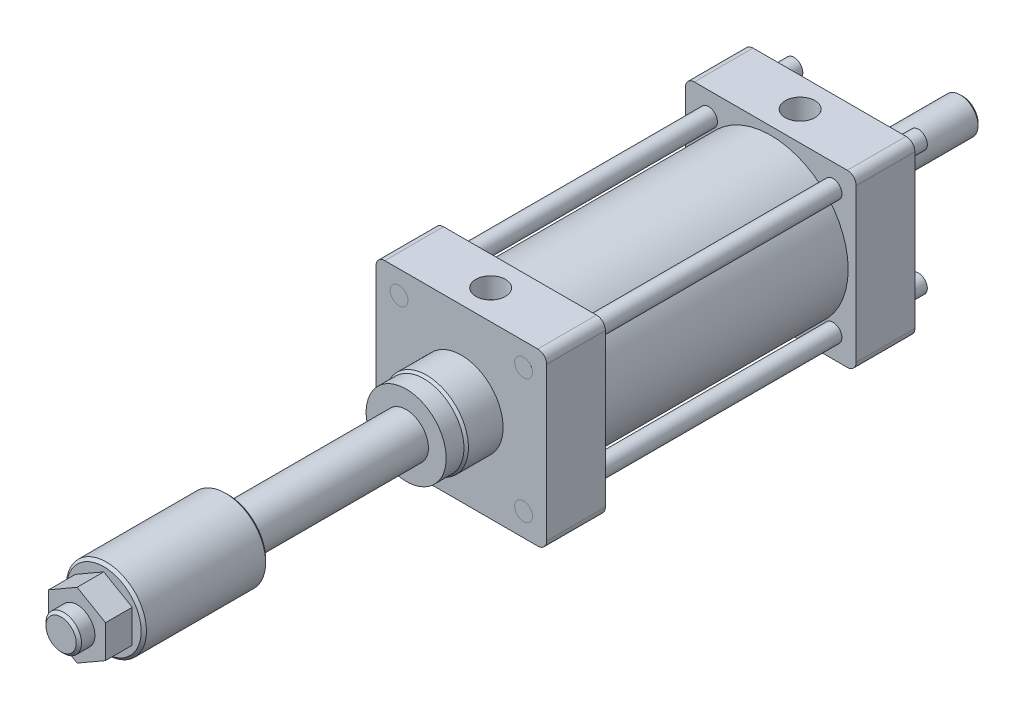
SolidWorks part; units mm, degrees
ref_plane "前视基准面" through (0, 0, 0) normal (0, 0, 1) x (1, 0, 0)
ref_plane "上视基准面" through (0, 0, 0) normal (0, 1, 0) x (1, 0, 0)
ref_plane "右视基准面" through (0, 0, 0) normal (1, 0, 0) x (0, 0, -1)
sketch "草图1" plane through (0, 0, 0) normal (0, 0, 1) x (1, 0, 0)
  line L0 (0, 0) -> (35, 0) construction
  line L1 (43, 48) -> (-43, 48)
  line L2 (48, 43) -> (48, -43)
  line L3 (43, -48) -> (-43, -48)
  line L4 (-48, 43) -> (-48, -43)
  line L5 (48, 48) -> (-48, -48) construction
  line L6 (48, -48) -> (-48, 48) construction
  line L7 (35, 0) -> (35, -35) construction
  arc A0 (-43, 48) -> (-48, 43) centre (-43, 43) ccw
  arc A1 (43, 48) -> (48, 43) centre (43, 43) cw
  arc A2 (48, -43) -> (43, -48) centre (43, -43) cw
  arc A3 (-48, -43) -> (-43, -48) centre (-43, -43) ccw
  circle A4 centre (35, -35) radius 5
  circle A5 centre (-35, -35) radius 5
  circle A6 centre (-35, 35) radius 5
  circle A7 centre (35, 35) radius 5
  point P0 (0, 0)
  point P31 (0, 0)
  dimension "D3" = 5
  dimension "D4" = 4
  dimension "D1" = 96
  dimension "D2" = 96
extrude "凸台-拉伸1" add sketch "草图1" along normal blind 33
sketch "草图2" plane through (0, 0, 0) normal (0, 0, -1) x (-1, 0, 0)
  circle A0 centre (0, 0) radius 23.5
extrude "凸台-拉伸2" add sketch "草图2" along normal blind 21
sketch "草图3" plane through (0, 0, -21) normal (0, 0, -1) x (-1, 0, 0)
  circle A0 centre (0, 0) radius 12.5
extrude "凸台-拉伸3" add sketch "草图3" along normal blind 14
sketch "草图4" plane through (0, 0, -35) normal (0, 0, -1) x (-1, 0, 0)
  circle A0 centre (0, 0) radius 10
extrude "凸台-拉伸4" add sketch "草图4" along normal blind 40
chamfer "倒角1" distance 1.5 angle 45 3 edges at (-10, 0, -75) (-12.5, 0, -35) (-23.5, 0, -21)
sketch "草图5" plane through (0, 0, 33) normal (0, 0, 1) x (1, 0, 0)
  circle A0 centre (0, 0) radius 43.5
extrude "凸台-拉伸5" add sketch "草图5" along normal blind 141
sketch "草图6" plane through (0, 0, 174) normal (0, 0, 1) x (1, 0, 0)
  line L4 (-48, 43) -> (-48, -43)
  line L5 (-43, -48) -> (43, -48)
  line L6 (48, -43) -> (48, 43)
  line L7 (43, 48) -> (-43, 48)
  line L8 (-48, 43) -> (-48, -43)
  line L9 (-43, -48) -> (43, -48)
  line L10 (48, -43) -> (48, 43)
  line L11 (43, 48) -> (-43, 48)
  circle A0 centre (35, 35) radius 5 construction
  circle A1 centre (35, -35) radius 5 construction
  circle A2 centre (-35, 35) radius 5 construction
  circle A3 centre (-35, -35) radius 5 construction
  arc A4 (-43, 48) -> (-48, 43) centre (-43, 43) ccw
  arc A5 (-48, -43) -> (-43, -48) centre (-43, -43) ccw
  arc A6 (43, -48) -> (48, -43) centre (43, -43) ccw
  arc A7 (48, 43) -> (43, 48) centre (43, 43) ccw
  arc A8 (-43, 48) -> (-48, 43) centre (-43, 43) ccw
  arc A9 (-48, -43) -> (-43, -48) centre (-43, -43) ccw
  arc A10 (43, -48) -> (48, -43) centre (43, -43) ccw
  arc A11 (48, 43) -> (43, 48) centre (43, 43) ccw
  circle A12 centre (35, 35) radius 5
  circle A13 centre (35, -35) radius 5
  circle A14 centre (-35, 35) radius 5
  circle A15 centre (-35, -35) radius 5
  dimension "D1" = 0
extrude "凸台-拉伸6" add sketch "草图6" along normal blind 33
sketch "草图7" plane through (0, 0, 207) normal (0, 0, 1) x (1, 0, 0)
  circle A0 centre (0, 0) radius 23.5
extrude "凸台-拉伸7" add sketch "草图7" along normal blind 21
chamfer "倒角2" distance 1.5 angle 45 1 edges at (23.5, 0, 228)
sketch "草图8" plane through (0, 0, 228) normal (0, 0, 1) x (1, 0, 0)
  circle A0 centre (0, 0) radius 22.5
extrude "凸台-拉伸8" add sketch "草图8" along normal blind 10
sketch "草图9" plane through (0, 0, 238) normal (0, 0, 1) x (1, 0, 0)
  circle A0 centre (0, 0) radius 12.5
  dimension "D1" = 25
extrude "凸台-拉伸10" add sketch "草图9" along normal blind 100
sketch "草图10" plane through (0, 0, 338) normal (0, 0, 1) x (1, 0, 0)
  circle A0 centre (0, 0) radius 22.5
extrude "凸台-拉伸11" add sketch "草图10" along normal blind 70
sketch "草图11" plane through (0, 0, 408) normal (0, 0, 1) x (1, 0, 0)
  line L1 (0, 18.4752) -> (-16, 9.2376)
  line L2 (-16, 9.2376) -> (-16, -9.2376)
  line L3 (-16, -9.2376) -> (0, -18.4752)
  line L4 (0, -18.4752) -> (16, -9.2376)
  line L5 (16, -9.2376) -> (16, 9.2376)
  line L6 (16, 9.2376) -> (0, 18.4752)
  circle A0 centre (0, 0) radius 16 construction
extrude "凸台-拉伸12" add sketch "草图11" along normal blind 15
sketch "草图12" plane through (0, 0, 423) normal (0, 0, 1) x (1, 0, 0)
  circle A0 centre (0, 0) radius 10
extrude "凸台-拉伸13" add sketch "草图12" along normal blind 9
chamfer "倒角3" distance 1.5 angle 45 3 edges at (22.5, 0, 338) (22.5, 0, 408) (10, 0, 432)
sketch "草图13" plane through (0, 0, 0) normal (0, 0, -1) x (-1, 0, 0)
  circle A0 centre (-35, -35) radius 5 construction
  circle A1 centre (35, -35) radius 5 construction
  circle A2 centre (35, 35) radius 5 construction
  circle A3 centre (-35, 35) radius 5 construction
  circle A4 centre (-35, -35) radius 5
  circle A5 centre (35, -35) radius 5
  circle A6 centre (35, 35) radius 5
  circle A7 centre (-35, 35) radius 5
extrude "凸台-拉伸14" add sketch "草图13" along normal blind 15 and the other way up to surface (207 mm away) separate body
hole_wizard "3/8 Rc 螺纹孔1" positions "草图14" profile "草图15" size "3/8" standard "ISO"
sketch "草图14" plane through (0, 48, 0) normal (0, 1, 0) x (1, 0, 0)
  line L0 (43, -33) -> (-43, -33) construction
  line L1 (43, -174) -> (-43, -174) construction
  point P0 (0, -16.5)
  point P2 (0, -190.5)
  dimension "D1" = 16.5
  dimension "D2" = 16.5
sketch "草图15" plane through (0, 48, 16.5) normal (1, 0, 0) x (0, 0, 1)
  line L0 (0, 0) -> (0, 22.3862)
  line L1 (7.15, 18.09) -> (0, 22.3862)
  line L2 (-7.15, 18.09) -> (0, 22.3862) construction
  line L3 (7.15, 18.09) -> (7.15, 11.4)
  line L4 (7.15, 11.4) -> (7.9751, 11.4)
  line L5 (7.9751, 11.4) -> (8.331, 0)
  line L6 (-7.9751, 11.4) -> (-8.331, 0) construction
  line L7 (8.331, 0) -> (0, 0)
  line L8 (0, -6.35) -> (0, 107.95) construction
  line L11 (-7.15, 11.4) -> (-7.9751, 11.4) construction
  dimension "螺纹孔钻头直径" = 14.3
  dimension "螺纹孔钻头深度" = 18.09
  dimension "螺纹直径" = 16.662
  dimension "螺纹角度" = 3.576
  dimension "螺纹深度" = 11.4
  dimension "导头角度" = 118
